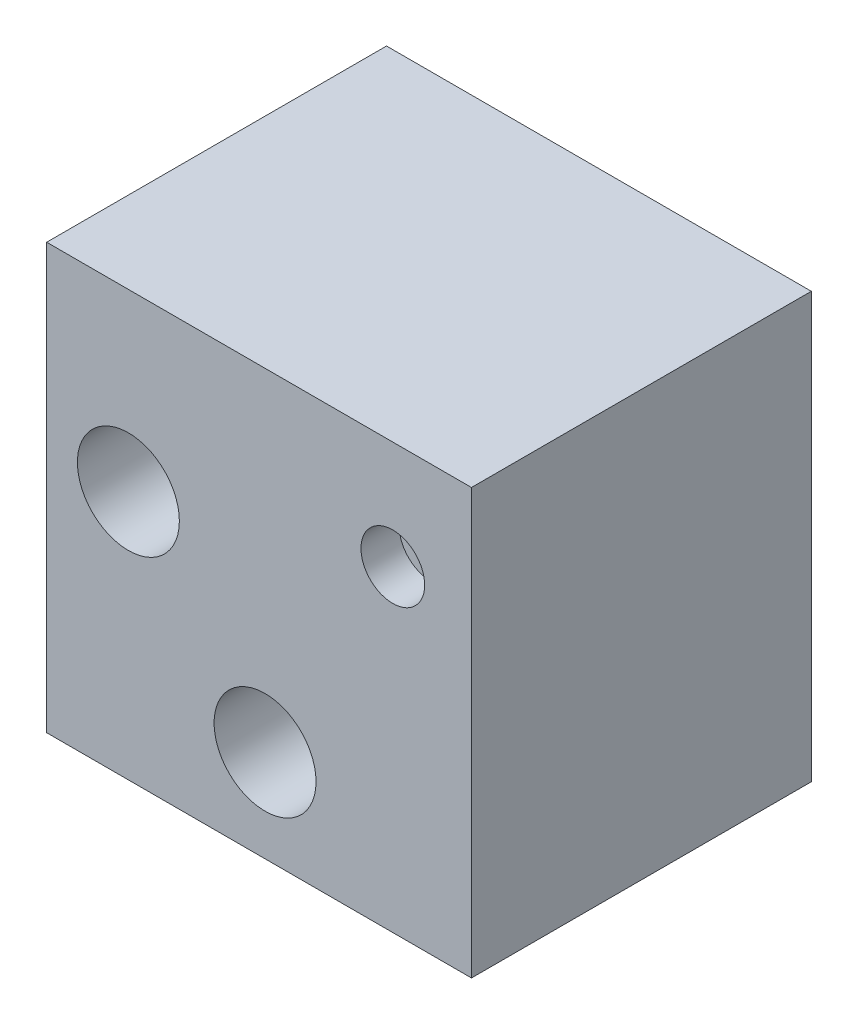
SolidWorks part; units mm, degrees
ref_plane "Přední rovina" through (0, 0, 0) normal (0, 0, 1) x (1, 0, 0)
ref_plane "Horní rovina" through (0, 0, 0) normal (0, 1, 0) x (1, 0, 0)
ref_plane "Pravá rovina" through (0, 0, 0) normal (1, 0, 0) x (0, 0, -1)
sketch "Skica1" plane through (0, 0, 0) normal (0, 0, 1) x (1, 0, 0)
  line L1 (0, 0) -> (100, 0)
  line L2 (0, 0) -> (0, 100)
  line L3 (0, 100) -> (100, 100)
  line L4 (100, 0) -> (100, 100)
  dimension "D1" = 100
  dimension "D2" = 100
extrude "Přidat vysunutím1" add sketch "Skica1" along normal blind 80
hole_wizard "Díra1" positions "Skica3" profile "Skica2" legacy
sketch "Skica3" plane through (0, 0, 80) normal (0, 0, 1) x (1, 0, 0)
  point P0 (19.2361, 58.7671)
  point P3 (51.4111, 21.7049)
sketch "Skica2" plane through (19.2361, 58.7671, 80) normal (1, 0, 0) x (0, -1, 0)
  line L0 (0, 0) -> (0, 63.0043)
  line L1 (0, 63.0043) -> (5, 60)
  line L2 (5, 60) -> (5, 35)
  line L3 (6.2, 20) -> (12, 20)
  line L4 (12, 0) -> (0, 0)
  line L5 (0, -11.3109) -> (0, 121.1557) construction
  line L6 (0, 63.0043) -> (-5, 60) construction
  line L7 (12, 20) -> (12, 0)
  line L8 (6.2, 20) -> (6.2, 35)
  line L9 (6.2, 35) -> (5, 35)
  dimension "Průměr" = 10
  dimension "Hloubka" = 60
  dimension "Průměr válc. zahloubení" = 24
  dimension "Hloubka válc. zahloubení" = 20
  dimension "Úhel vrtání" = 118
hole_wizard "Díra2" positions "Skica5" profile "Skica4" legacy
sketch "Skica5" plane through (0, 0, 80) normal (0, 0, 1) x (1, 0, 0)
  point P0 (81.4799, 74.5869)
sketch "Skica4" plane through (81.4799, 74.5869, 80) normal (1, 0, 0) x (0, -1, 0)
  line L0 (0, 0) -> (0, 80)
  line L1 (0, 80) -> (4.2, 80)
  line L2 (4.2, 80) -> (4.2, 9)
  line L3 (4.2, 9) -> (7.5, 9)
  line L4 (7.5, 9) -> (7.5, 0)
  line L5 (7.5, 0) -> (0, 0)
  line L6 (0, 110) -> (0, -10) construction
  dimension "Průměr" = 8.4
  dimension "Hloubka" = 80
  dimension "Průměr válc. zahloubení" = 15
  dimension "Hloubka válc. zahloubení" = 9
